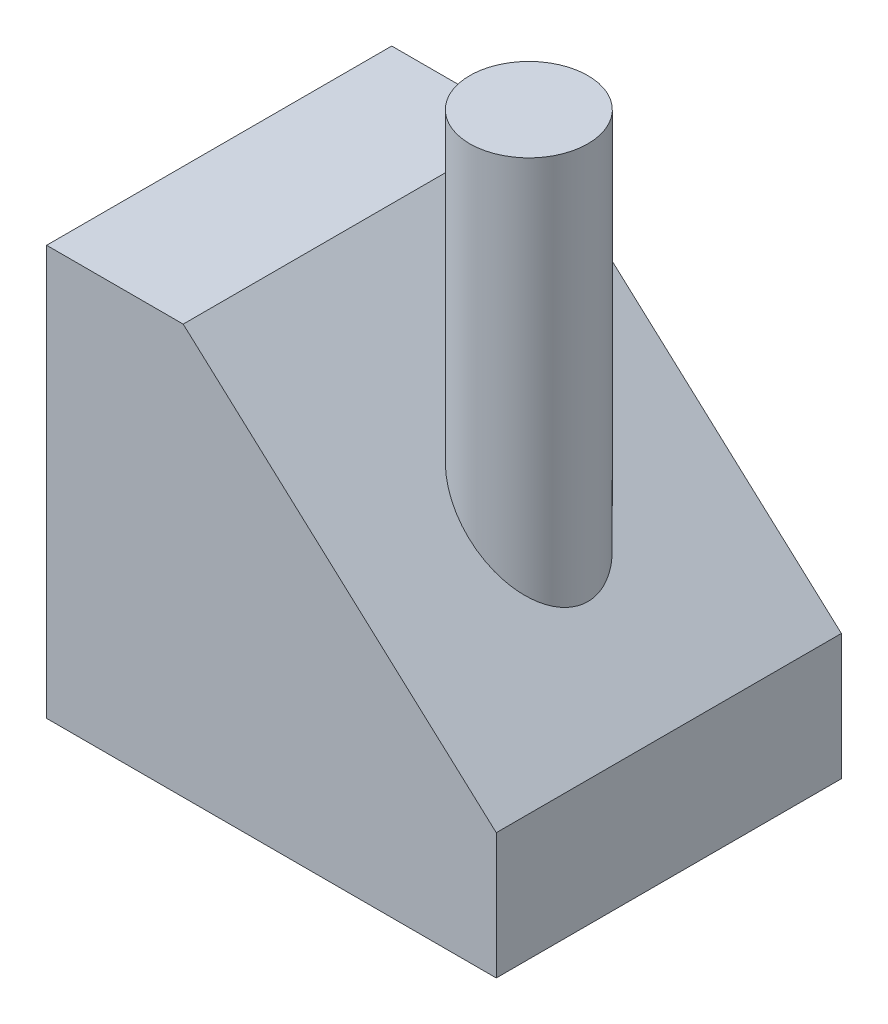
SolidWorks part; units mm, degrees
ref_plane "Front" through (0, 0, 0) normal (0, 0, 1) x (1, 0, 0)
ref_plane "Top" through (0, 0, 0) normal (0, 1, 0) x (1, 0, 0)
ref_plane "Right" through (0, 0, 0) normal (1, 0, 0) x (0, 0, -1)
ref_plane "Plane1" through (0, 0, 75.1895) normal (0, 0, 1) x (1, 0, 0)
sketch "Sketch2" plane through (0, 0, 0) normal (0, 0, 1) x (1, 0, 0)
  line L0 (0, 0) -> (109.4441, 0)
  line L1 (109.4441, 0) -> (109.4441, 30.6294)
  line L2 (109.4441, 30.6294) -> (33.2441, 99.7324)
  line L3 (33.2441, 99.7324) -> (0, 99.7324)
  line L4 (0, 99.7324) -> (0, 0)
extrude "Extrude1" add sketch "Sketch2" along normal mid plane 84
sketch "Sketch3" plane through (0, 0, 0) normal (0, 1, 0) x (1, 0, 0)
  circle A0 centre (75.3688, 0) radius 14.381
extrude "Extrude2" add sketch "Sketch3" along normal blind 145
